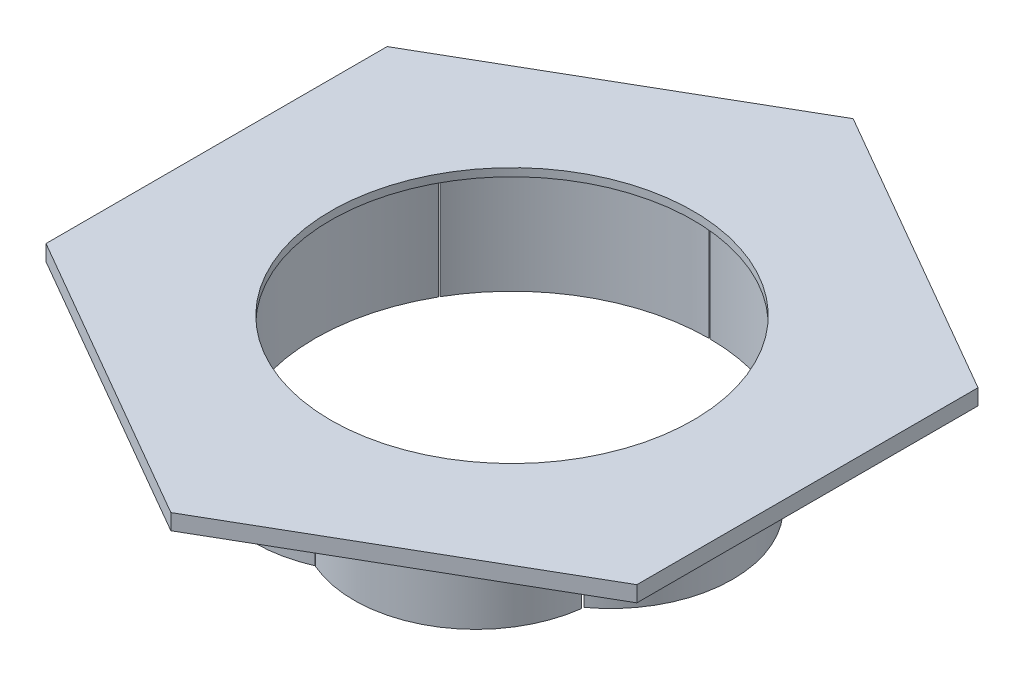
SolidWorks part; units mm, degrees
ref_plane "Front Plane" through (0, 0, 0) normal (0, 0, 1) x (1, 0, 0)
ref_plane "Top Plane" through (0, 0, 0) normal (0, 1, 0) x (1, 0, 0)
ref_plane "Right Plane" through (0, 0, 0) normal (1, 0, 0) x (0, 0, -1)
sketch "Sketch1" plane through (0, 0, 0) normal (0, 1, 0) x (1, 0, 0)
  line L1 (0, 549.91) -> (-476.236, 274.955)
  line L2 (-476.236, 274.955) -> (-476.236, -274.955)
  line L3 (-476.236, -274.955) -> (0, -549.91)
  line L4 (0, -549.91) -> (476.236, -274.955)
  line L5 (476.236, -274.955) -> (476.236, 274.955)
  line L6 (476.236, 274.955) -> (0, 549.91)
  circle A0 centre (0, 0) radius 317.5
  circle A1 centre (0, 0) radius 476.236 construction
extrude "Boss-Extrude2" add sketch "Sketch1" along normal blind 25.4
sketch "Sketch2" plane through (0, 0, 0) normal (0, -1, 0) x (1, 0, 0)
  line L0 (0, 549.91) -> (0, -549.91)
  line L1 (-476.236, 274.955) -> (476.236, -274.955)
  line L2 (-476.236, -274.955) -> (476.236, 274.955)
  line L3 (238.118, 412.4325) -> (-238.118, -412.4325)
  line L4 (0, 549.91) -> (476.236, 274.955) construction
  line L5 (0, -549.91) -> (-476.236, -274.955) construction
  line L6 (-476.236, 0) -> (476.236, 0)
  line L7 (-476.236, -274.955) -> (-476.236, 274.955) construction
  line L8 (476.236, 274.955) -> (476.236, -274.955) construction
  line L9 (-238.118, 412.4325) -> (238.118, -412.4325)
  line L10 (-476.236, 274.955) -> (0, 549.91) construction
  line L11 (476.236, -274.955) -> (0, -549.91) construction
  line L12 (177.8, -307.9586) -> (79.508, -137.7118)
  line L13 (-177.8, -307.9586) -> (-79.508, -137.7118)
  line L14 (-355.6, 0) -> (-158.75, 0)
  line L15 (-177.8, 307.9586) -> (-79.508, 137.7118)
  circle A0 centre (0, 0) radius 355.6
  arc A1 (0, 317.5) -> (274.9631, 158.75) centre (79.508, 137.7118) cw
  circle A2 centre (0, 0) radius 317.5 construction
  arc A3 (274.9631, 158.75) -> (274.9631, -158.75) centre (159.0159, 0) cw
  arc A4 (0, 317.5) -> (-158.75, 274.9631) centre (0, 0) ccw
  arc A5 (-158.75, 274.9631) -> (0, 317.5) centre (0, 0) cw
  arc A6 (274.9631, -158.75) -> (0, -317.5) centre (79.508, -137.7118) cw
  arc A7 (0, -317.5) -> (-274.9631, -158.75) centre (-79.508, -137.7118) cw
  arc A8 (-274.9631, -158.75) -> (-274.9631, 158.75) centre (-158.75, 0) cw
  arc A9 (-274.9631, 158.75) -> (0, 317.5) centre (-79.508, 137.7118) cw
extrude "Boss-Extrude4" add sketch "Sketch2" along normal blind 165.1 contours A9 L9 M7 | A9 L9 M7 | A3 L6 M7 | A3 L6 M7 | A7 L3 M7 | A7 L3 M7
sketch "Sketch3" plane through (0, 0, 0) normal (0, -1, 0) x (1, 0, 0)
  line L0 (0, 0) -> (79.502, 137.7015)
  line L1 (1.1256, 317.9935) -> (1.1256, 317.498)
  line L2 (274.4989, 162.6869) -> (272.6522, 162.6869)
  line L4 (0, 0) -> (-159.004, 0)
  line L7 (0, 0) -> (79.502, -137.7015)
  arc A0 (272.6522, 162.6869) -> (1.1256, 317.498) centre (0, 0) ccw
  arc A1 (274.4989, 162.6869) -> (1.1256, 317.9935) centre (79.502, 137.7015) ccw
  arc A3 (-274.9631, 158.75) -> (-274.9631, -158.75) centre (-159.004, 0) ccw
  arc A4 (-274.9631, 158.75) -> (-274.9631, -158.75) centre (0, 0) ccw construction
  arc A5 (-274.9631, -158.75) -> (0, -317.5) centre (-79.508, -137.7118) ccw construction
  arc A6 (274.9631, -158.75) -> (0, -317.5) centre (79.502, -137.7015) cw
  arc A7 (0, -317.5) -> (274.9631, -158.75) centre (0, 0) ccw construction
  arc A8 (-274.9631, 158.75) -> (274.9631, 158.75) centre (0, 0) ccw
sketch "Sketch5" plane through (0, 0, 0) normal (0, -1, 0) x (1, 0, 0)
  circle A0 centre (0, 0) radius 317.5
sketch "Sketch6" plane through (0, 0, 0) normal (0, -1, 0) x (1, 0, 0)
extrude "Boss-Extrude5" add sketch "Sketch3" along normal blind 165.1 contours A1 L1 A0 L2
sketch "Sketch9" plane through (0, 0, 0) normal (0, -1, 0) x (1, 0, 0)
  line L0 (-476.236, 0) -> (476.236, 0)
  line L1 (-476.236, -274.955) -> (-476.236, 274.955) construction
  line L2 (476.236, 274.955) -> (476.236, -274.955) construction
  line L3 (238.118, -412.4325) -> (-238.118, 412.4325)
  line L4 (476.236, -274.955) -> (0, -549.91) construction
  line L5 (-476.236, 274.955) -> (0, 549.91) construction
  line L6 (-278.0674, 156.4355) -> (-276.7156, 155.675)
  line L7 (-275.7826, -157.322) -> (-276.4123, -157.6813)
  line L8 (0.9525, -317.9182) -> (0.9525, -317.4986)
  line L9 (274.9551, -158.8243) -> (274.8309, -158.9788)
  arc A0 (-276.7156, 155.675) -> (-275.7826, -157.322) centre (0, 0) ccw
  arc A1 (-276.4123, -157.6813) -> (-278.0674, 156.4355) centre (-159.0159, 0) cw
  arc A2 (274.9551, -158.8243) -> (0.9525, -317.9182) centre (79.508, -137.7118) cw
  arc A3 (-274.9631, -158.75) -> (0, -317.5) centre (0, 0) ccw
  arc A4 (0.9525, -317.4986) -> (274.8309, -158.9788) centre (0, 0) ccw
  arc A5 (274.9631, -158.75) -> (-158.75, 274.9631) centre (0, 0) ccw
extrude "Boss-Extrude6" add sketch "Sketch9" along normal blind 165.1 contours A1 L6 A0 L7
sketch "Sketch10" plane through (0, 0, 0) normal (0, -1, 0) x (1, 0, 0)
  line L0 (238.118, -412.4325) -> (-238.118, 412.4325)
  line L1 (476.236, -274.955) -> (0, -549.91) construction
  line L2 (-476.236, 274.955) -> (0, 549.91) construction
  line L3 (274.8578, -158.9322) -> (274.9327, -158.9404)
  line L4 (274.9327, -158.9404) -> (274.9425, -158.9404)
  line L5 (1.4821, -317.4965) -> (1.0276, -317.951)
  arc A0 (274.9631, -158.75) -> (0, -317.5) centre (0, 0) ccw
  arc A1 (274.9425, -158.9404) -> (1.0276, -317.951) centre (79.508, -137.7118) cw
  arc A2 (1.4821, -317.4965) -> (274.8578, -158.9322) centre (0, 0) ccw
extrude "Boss-Extrude7" add sketch "Sketch10" along normal blind 165.1 contours A1 L0 L5 M13 | A1 L4 L3 L0 M13
sketch "Sketch12" plane through (0, 25.4, 0) normal (0, 1, 0) x (1, 0, 0)
  circle A0 centre (0, 0) radius 317.5
  circle A1 centre (0, 0) radius 292.1
extrude "Boss-Extrude8" add sketch "Sketch12" against normal blind 12.7
scale "Scale1" scale about centroid uniform scaling yes scale factor 0.039467
sketch "Sketch13" plane through (0, -24.123, 0) normal (0, 1, 0) x (1, 0, 0)
  line L0 (-0.002, 0.0094) -> (-0.002, 11.5376)
